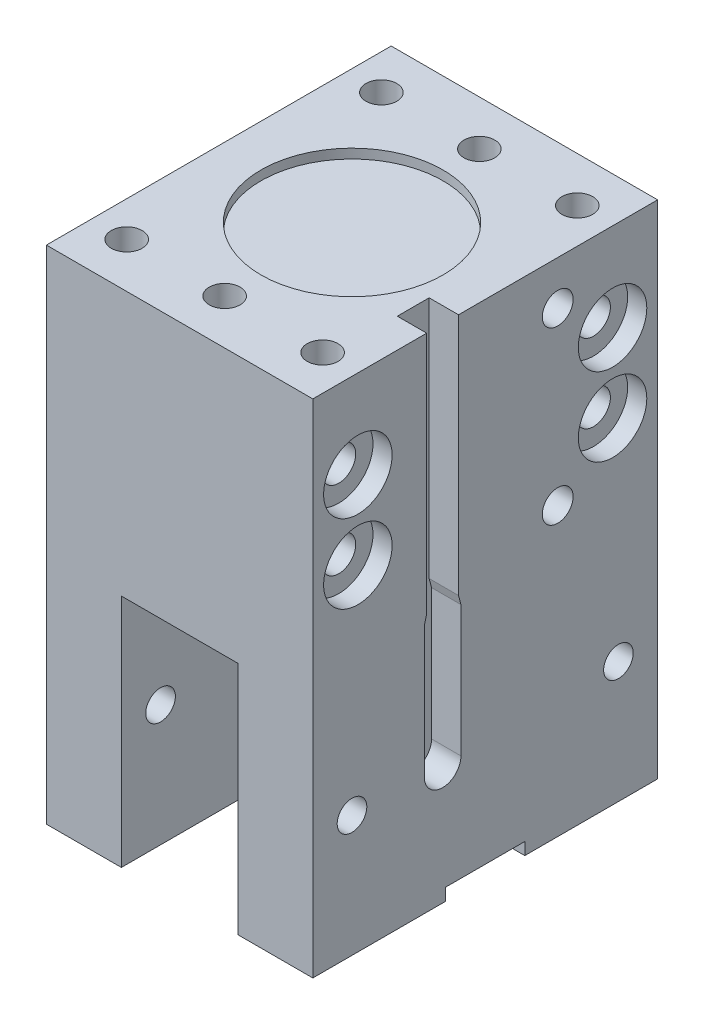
SolidWorks part; units mm, degrees
ref_plane "Front/Back" through (0, 0, 0) normal (0, 0, 1) x (1, 0, 0)
ref_plane "Top/Bottom" through (0, 0, 0) normal (0, 1, 0) x (1, 0, 0)
ref_plane "Right/Left" through (0, 0, 0) normal (1, 0, 0) x (0, 0, -1)
sketch "Sketch1" plane through (0, 0, 0) normal (0, 1, 0) x (1, 0, 0)
  line L0 (0, 0) -> (21.59, 0) construction
  line L1 (-21.59, 27.94) -> (21.59, 27.94)
  line L2 (-21.59, 27.94) -> (-21.59, -27.94)
  line L3 (-21.59, -27.94) -> (21.59, -27.94)
  line L4 (21.59, 27.94) -> (21.59, -27.94)
  line L5 (0, 0) -> (0, 27.94) construction
  dimension "D1" = 43.18
  dimension "D2" = 55.88
extrude "Extrude1" add sketch "Sketch1" along normal mid plane 81.28
hole_wizard "M6 X 1.0 (Mount Holes)" positions "Sketch3" profile "Sketch2" tap size "M6x1.0" standard "Ansi Metric"
sketch "Sketch3" plane through (0, 40.64, 0) normal (0, 1, 0) x (-1, 0, 0)
  line L0 (0, 0) -> (0, 56.7657) construction
  line L1 (0, 0) -> (40.0234, 0) construction
  point P0 (-15.875, -20.6375)
  point P1 (-15.875, 20.6375)
  point P2 (15.875, 20.6375)
  point P3 (15.875, -20.6375)
  dimension "D1" = 31.75
  dimension "D2" = 41.275
sketch "Sketch2" plane through (15.875, 40.64, -20.6375) normal (1, 0, 0) x (0, 0, 1)
  line L0 (0, 0) -> (0, 10.5022)
  line L1 (0, 10.5022) -> (2.5, 9)
  line L2 (2.5, 9) -> (2.5, 0)
  line L5 (2.5, 0) -> (0, 0)
  line L10 (0, 10.5022) -> (-2.5, 9) construction
  line L11 (0, -6.35) -> (0, 107.95) construction
  dimension "Tap Drill Dia." = 5
  dimension "Tap Drill Depth" = 9
  dimension "Drill Angle" = 118
sketch "Sketch4" plane through (0, 40.64, 0) normal (0, 1, 0) x (-1, 0, 0)
  line L0 (0, 0) -> (0, 54.61) construction
  line L1 (0, 0) -> (38.8737, 0) construction
  circle A0 centre (0, 20.6375) radius 2.5
  circle A1 centre (0, -20.6375) radius 2.5
  dimension "D1" = 5
  dimension "D2" = 41.275
extrude "(5MM Dowel Holes - Slip Fit)" cut sketch "Sketch4" against normal blind 8
sketch "Sketch5" plane through (0, 40.64, 0) normal (0, 1, 0) x (-1, 0, 0)
  circle A0 centre (0, 0) radius 14.75
  dimension "D1" = 29.5
extrude "Cut-Extrude2" cut sketch "Sketch5" against normal blind 1.524
hole_wizard "M5x0.8 Tapped Hole1" positions "Sketch8" profile "Sketch7" tap size "M5x0.8" standard "Ansi Metric"
sketch "Sketch8" plane through (21.59, 0, 0) normal (1, 0, 0) x (0, 0, -1)
  line L0 (0, 0) -> (56.2585, 0) construction
  line L1 (0, 0) -> (0, 66.6035) construction
  line L2 (0, 39.116) -> (0, 40.64) construction
  line L3 (-27.94, 40.64) -> (27.94, 40.64) construction
  point P0 (11.7475, 33.528)
  point P1 (11.7475, 5.842)
  dimension "D1" = 27.686
  dimension "D2" = 7.112
  dimension "D3" = 11.7475
sketch "Sketch7" plane through (21.59, 33.528, -11.7475) normal (0, 1, 0) x (0, 0, -1)
  line L0 (0, 0) -> (0, 14.8618)
  line L1 (0, 14.8618) -> (2.1, 13.6)
  line L2 (2.1, 13.6) -> (2.1, 9.6)
  line L3 (2.1, 9.6) -> (2.5, 9.6)
  line L4 (2.5, 9.6) -> (2.5, 0)
  line L5 (2.5, 0) -> (0, 0)
  line L10 (0, 14.8618) -> (-2.1, 13.6) construction
  line L11 (0, -6.35) -> (0, 107.95) construction
  dimension "Tap Drill Dia." = 4.2
  dimension "Tap Drill Depth" = 13.6
  dimension "Thread Major Dia." = 5
  dimension "Thread Depth" = 9.6
  dimension "Drill Angle" = 118
hole_wizard "M6X1.0 (Mount Holes)" positions "Sketch11" profile "Sketch10" tap size "M6x1.0" standard "Ansi Metric"
sketch "Sketch11" plane through (-21.59, 0, 0) normal (-1, 0, 0) x (0, 0, 1)
  line L0 (0, 0) -> (56.4909, 0) construction
  line L1 (0, 0) -> (0, 67.5334) construction
  line L2 (0, 39.116) -> (0, 40.64) construction
  line L3 (-27.94, 40.64) -> (27.94, 40.64) construction
  point P0 (-20.6375, 26.3525)
  point P1 (20.6375, 26.3525)
  point P2 (20.6375, 13.6525)
  point P3 (-20.6375, 13.6525)
  dimension "D1" = 41.275
  dimension "D2" = 14.2875
  dimension "D3" = 12.7
sketch "Sketch10" plane through (-21.59, 26.3525, -20.6375) normal (0, 1, 0) x (0, 0, 1)
  line L0 (0, 0) -> (0, 15.5022)
  line L1 (0, 15.5022) -> (2.5, 14)
  line L2 (2.5, 14) -> (2.5, 0)
  line L5 (2.5, 0) -> (0, 0)
  line L10 (0, 15.5022) -> (-2.5, 14) construction
  line L11 (0, -6.35) -> (0, 107.95) construction
  dimension "Tap Drill Dia." = 5
  dimension "Tap Drill Depth" = 14
  dimension "Drill Angle" = 118
hole_wizard "CBORE for M5 SHCS1" positions "3DSketch1" profile "Sketch19" counterbore size "M5" standard "Ansi Metric"
sketch3d "3DSketch1"
  line L0 (21.59, 13.6525, 20.6375) -> (21.59, 13.6525, -20.6375) construction
  line L2 (21.59, 13.6525, 20.6375) -> (21.59, 26.3525, 20.6375) construction
  line L4 (21.59, 26.3525, 20.6375) -> (21.59, 26.3525, -20.6375) construction
  line L5 (21.59, 26.3525, -20.6375) -> (21.59, 13.6525, -20.6375) construction
  line L6 (21.59, 40.64, 27.94) -> (21.59, 40.64, -27.94) construction
  line L8 (21.59, 40.64, 27.94) -> (21.59, -40.64, 27.94) construction
  point P0 (21.59, 26.3525, -20.6375)
  point P2 (21.59, 13.6525, 20.6375)
  point P4 (21.59, 26.3525, -20.6375)
  point P6 (21.59, 13.6525, -20.6375)
  point P30 (21.59, 26.3525, 20.6375)
  dimension "D1" = 41.275
  dimension "D2" = 7.3025
  dimension "D3" = 12.7
  dimension "D4" = 14.2875
sketch "Sketch19" plane through (21.59, 26.3525, -20.6375) normal (0, 1, 0) x (0, 0, -1)
  line L0 (0, 0) -> (0, 32.1324)
  line L1 (0, 32.1324) -> (2.75, 30.48)
  line L2 (2.75, 30.48) -> (2.75, 3.1)
  line L3 (2.75, 3.1) -> (5.55, 3.1)
  line L4 (5.55, 3.1) -> (5.55, 0)
  line L5 (5.55, 0) -> (0, 0)
  line L10 (0, 32.1324) -> (-2.75, 30.48) construction
  line L11 (0, -6.35) -> (0, 107.95) construction
  dimension "Hole Dia." = 5.5
  dimension "Hole Depth" = 30.48
  dimension "C'Bore Dia." = 11.1
  dimension "C'Bore Depth" = 3.1
  dimension "Drill Angle" = 118
sketch "Sketch12" plane through (-21.59, 0, 0) normal (-1, 0, 0) x (0, 0, 1)
  circle A0 centre (-20.6375, 20.0025) radius 2.5
  circle A1 centre (20.6375, 20.0025) radius 2.5
  dimension "D1" = 6.35
  dimension "D2" = 5
extrude "(5MM  Dowel Holes - Slip Fit )" cut sketch "Sketch12" against normal blind 6
sketch "Sketch13" plane through (21.59, 0, 0) normal (1, 0, 0) x (0, 0, -1)
  line L0 (0, 0) -> (60.443, 0) construction
  line L1 (0, 0) -> (0, 66.836) construction
  line L2 (0, 39.116) -> (0, 40.64) construction
  line L4 (-27.94, -40.64) -> (27.94, -40.64) construction
  circle A0 centre (21.59, -20.9804) radius 2.4
  circle A1 centre (-21.59, -20.9804) radius 2.4
  dimension "D1" = 4.8
  dimension "D2" = 19.6596
  dimension "D3" = 43.18
extrude "Cut-Extrude5" cut sketch "Sketch13" against normal through all
sketch "Sketch14" plane through (21.59, 0, 0) normal (1, 0, 0) x (0, 0, -1)
  line L0 (0, 0) -> (0, 67.0685) construction
  line L1 (0, 39.116) -> (0, 40.64) construction
  line L2 (0, 0) -> (61.3729, 0) construction
  line L3 (-3.9338, -21.471) -> (-3.9338, -0.2381)
  line L4 (-9.8774, -21.471) -> (-9.8774, -0.2381)
  line L5 (-9.4853, 40.64) -> (-4.3259, 40.64)
  line L6 (-27.94, 40.64) -> (-27.94, -40.64) construction
  line L7 (-27.94, 40.64) -> (27.94, 40.64) construction
  line L8 (-9.4853, 40.64) -> (-9.4853, 1.2469)
  line L9 (-9.4853, 1.2469) -> (-9.8774, -0.2381)
  line L10 (-4.3259, 40.64) -> (-4.3259, 1.2469)
  line L11 (-4.3259, 1.2469) -> (-3.9338, -0.2381)
  arc A0 (-9.8774, -21.471) -> (-3.9338, -21.471) centre (-6.9056, -21.471) ccw
  point P12 (-6.9056, 40.64)
  dimension "D2" = 2.9718
  dimension "D1" = 21.0344
  dimension "D3" = 62.111
  dimension "D4" = 5.1594
  dimension "D5" = 1.485
  dimension "D6" = 39.3931
extrude "Cut-Extrude6" cut sketch "Sketch14" against normal blind 4.7625
sketch "Sketch15" plane through (0, 0, 27.94) normal (0, 0, 1) x (1, 0, 0)
  line L0 (0, 0) -> (49.0518, 0) construction
  line L1 (0, 0) -> (0, 66.836) construction
  line L2 (0, 32.64) -> (0, 40.64) construction
  line L3 (-21.59, -40.64) -> (21.59, -40.64) construction
  line L4 (-9.4361, -40.64) -> (9.4361, -40.64)
  line L5 (-9.4361, -40.64) -> (-9.4361, -2.54)
  line L6 (-9.4361, -2.54) -> (9.4361, -2.54)
  line L7 (9.4361, -40.64) -> (9.4361, -2.54)
  line L8 (-21.59, 40.64) -> (21.59, 40.64) construction
  dimension "D1" = 18.8722
  dimension "D2" = 43.18
extrude "Cut-Extrude7" cut sketch "Sketch15" against normal through all
sketch "Sketch16" plane through (21.59, 0, 0) normal (1, 0, 0) x (0, 0, -1)
  line L0 (-27.94, -40.64) -> (27.94, -40.64) construction
  line L1 (-6.4135, -40.64) -> (6.4135, -40.64)
  line L2 (-6.4135, -40.64) -> (-6.4135, -38.6556)
  line L3 (-6.4135, -38.6556) -> (6.4135, -38.6556)
  line L4 (6.4135, -40.64) -> (6.4135, -38.6556)
  line L5 (0, 0) -> (0, 79.7875) construction
  line L6 (0, 39.116) -> (0, 40.64) construction
  dimension "D1" = 12.827
  dimension "D2" = 1.9844
extrude "Cut-Extrude8" cut sketch "Sketch16" against normal through all
hole_wizard "M8x1.25 Tapped Hole1" positions "Sketch18" profile "Sketch17" tap size "M8x1.25" standard "Ansi Metric"
sketch "Sketch18" plane through (0, -38.6556, 0) normal (0, -1, 0) x (1, 0, 0)
  line L0 (0, 0) -> (40.3108, 0) construction
  line L1 (0, 0) -> (0, 59.2088) construction
  point P0 (14.224, 0)
  point P1 (-14.224, 0)
  dimension "D1" = 28.448
sketch "Sketch17" plane through (14.224, -38.6556, 0) normal (1, 0, 0) x (0, 0, -1)
  line L0 (0, 0) -> (0, 25.0429)
  line L1 (0, 25.0429) -> (3.4, 23)
  line L2 (3.4, 23) -> (3.4, 0)
  line L5 (3.4, 0) -> (0, 0)
  line L10 (0, 25.0429) -> (-3.4, 23) construction
  line L11 (0, -6.35) -> (0, 107.95) construction
  dimension "Tap Drill Dia." = 6.8
  dimension "Tap Drill Depth" = 23
  dimension "Drill Angle" = 118
